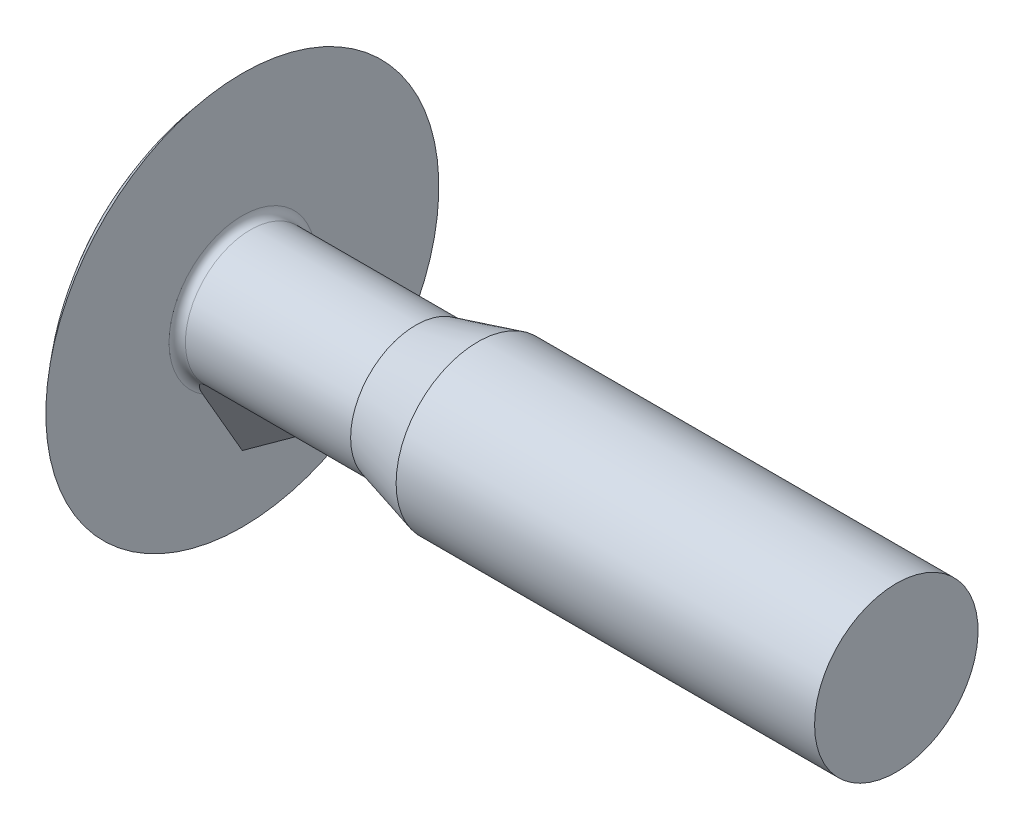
SolidWorks part; units mm, degrees
ref_plane "Front" through (0, 0, 0) normal (0, 0, 1) x (1, 0, 0)
ref_plane "Top" through (0, 0, 0) normal (0, 1, 0) x (1, 0, 0)
ref_plane "Right" through (0, 0, 0) normal (1, 0, 0) x (0, 0, -1)
sketch "Sketch1" plane through (-7.6906, 4.3277, 0) normal (0, 0, 1) x (0, 1, 0)
  line L0 (-4.3277, -12.2906) -> (-16.3461, -12.2906)
  line L1 (-4.3277, 1.3165) -> (-4.3277, -29.2605) construction
  line L2 (-4.3277, -12.2906) -> (-4.3277, -7.6906)
  arc A0 (-4.3277, -7.6906) -> (-16.3461, -12.2906) centre (-4.3277, -25.6906) ccw
  dimension "r" = 18
  dimension "k" = 4.6
revolve "BaseHead" add sketch "Sketch1" angle 360 about L1
sketch "Sketch2" plane through (4.6, 0, 0) normal (1, 0, 0) x (0, 0, -1)
  circle A0 centre (0, 0) radius 5
extrude "BaseBody" add sketch "Sketch2" along normal blind 40
sketch "Sketch3" plane through (-15.8544, 0, 20.8544) normal (0, 1, 0) x (0, 0, -1)
  line L0 (20.8544, 6.1636) -> (20.8544, -42.8724) construction
  line L1 (25.8544, -34.8604) -> (24.8362, -31.0604)
  line L2 (20.8544, -60.4544) -> (20.8544, -20.4544) construction
  line L3 (24.8362, -31.0604) -> (24.8362, -20.4544)
  line L4 (25.8544, -60.4544) -> (25.8544, -20.4544) construction
  line L5 (24.8362, -20.4544) -> (25.8544, -20.4544)
  line L6 (25.8544, -20.4544) -> (25.8544, -34.8604)
  line L7 (15.8544, -20.4544) -> (25.8544, -20.4544) construction
  line L8 (8.8361, -20.4544) -> (32.8727, -20.4544) construction
  line L9 (15.8544, -60.4544) -> (25.8544, -60.4544) construction
  dimension "D1" = 15
  dimension "x" = 3.8
revolve "Cut-Revolve1" cut sketch "Sketch3" angle 360 about L0
fillet "Fillet1" radius 0.5 1 edges at (4.6, 0, 3.9818)
ref_plane "Plan1" through (10.1, 0, 0) normal (1, 0, 0) x (0, 0, -1)
sketch "Sketch4" plane through (4.6, 10.7187, 8.8426) normal (1, 0, 0) x (0, 0, 1)
  line L0 (-12.291, 12.7096) -> (-8.8426, 18.6823)
  line L1 (-8.8426, 18.6823) -> (-5.3943, 12.7096)
  line L2 (-12.291, 12.7096) -> (-5.3943, 12.7096)
  circle A0 centre (-8.8426, 10.7187) radius 3.9818 construction
  point P5 (-8.8426, 12.7096)
  dimension "D1" = 60
sketch "Sketch5" plane through (10.1, 0, 0) normal (1, 0, 0) x (0, 0, -1)
  line L0 (0, 0) -> (0, -9.3883) construction
  circle A0 centre (0, 0) radius 3.9818 construction
  circle A1 centre (0, 0) radius 3.9818 construction
  point P6 (0, -3.9818)
loft "Nib" add profiles "Sketch4", "Sketch5"
sketch "Sketch6" plane through (0, 0, 0) normal (0, 0, 1) x (1, 0, 0)
  line L0 (44.194, 5.2) -> (45.006, 5.2)
  line L1 (45.006, 5.2) -> (45.006, 5)
  line L2 (45.006, 5) -> (44.6, 4.2968)
  line L3 (44.194, 5) -> (44.6, 4.2968)
  line L4 (44.194, 5.2) -> (44.194, 5)
  line L5 (44.6, -5) -> (44.6, 5) construction
  line L6 (44.194, 5) -> (45.006, 5) construction
  line L7 (44.6, 5) -> (44.6, 4.2968) construction
  line L8 (44.6, 5) -> (19.006, 5) construction
  line L9 (0, 0) -> (56.0764, 0) construction
  point P5 (44.6, 5.2)
revolve "Cut-Revolve10" [suppressed] cut sketch "Sketch6" angle 360 about L9
pattern_linear "LPattern10" [suppressed] count 26 spacing 0.9744 along (1, 0, 0)
equation "\"D2@Sketch6\" = (  \"d@Sketch2\" - \"D2@ThreadCosmetic1\" )  / 2"
equation "\"D3@LPattern10\" = 1.2 * \"D2@Sketch6\""
equation "\"D1@LPattern10\" = \"b@ThreadCosmetic1\" / \"D3@LPattern10\""
